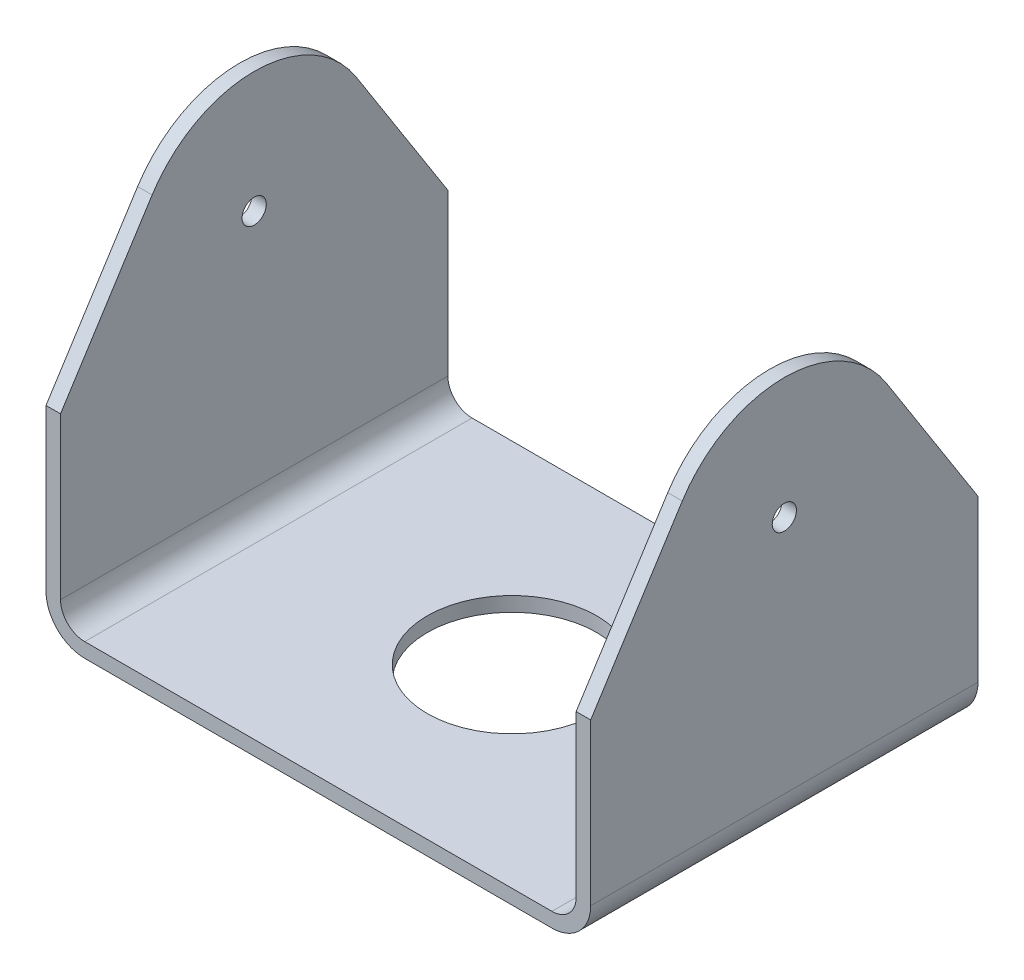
SolidWorks part; units mm, degrees
ref_plane "Plan de face" through (0, 0, 0) normal (0, 0, 1) x (1, 0, 0)
ref_plane "Plan de dessus" through (0, 0, 0) normal (0, 1, 0) x (1, 0, 0)
ref_plane "Plan de droite" through (0, 0, 0) normal (1, 0, 0) x (0, 0, -1)
sketch "Esquisse1" plane through (0, 0, 0) normal (0, 0, 1) x (1, 0, 0)
  line L0 (-56.25, 82.5) -> (-56.25, 0)
  line L1 (-56.25, 0) -> (56.25, 0)
  line L2 (56.25, 0) -> (56.25, 82.5)
  dimension "D1" = 112.5
  dimension "D2" = 82.5
extrude "Extru.-Mince1" add sketch "Esquisse1" along normal mid plane 80 thin
sketch "Esquisse2" plane through (0, 3, 0) normal (0, 1, 0) x (-1, 0, 0)
  circle A0 centre (0, 0) radius 17.5
  dimension "D1" = 35
extrude "Enlèv. mat.-Extru.1" cut sketch "Esquisse2" against normal up to next
sketch "Esquisse3" plane through (56.25, 0, 0) normal (1, 0, 0) x (0, 0, -1)
  line L1 (-40, 82.5) -> (40, 82.5) construction
  line L2 (-21.0848, 70.9325) -> (-40, 41.2416)
  line L3 (-40, 8) -> (-40, 82.5) construction
  line L4 (21.0848, 70.9325) -> (40, 41.2416)
  line L5 (40, 8) -> (40, 82.5) construction
  arc A0 (21.0848, 70.9325) -> (-21.0848, 70.9325) centre (0, 57.5) ccw
  dimension "D1" = 25
  dimension "D2" = 65
extrude "Enlèv. mat.-Extru.2" cut sketch "Esquisse3" against normal through all
sketch "Esquisse4" plane through (56.25, 0, 0) normal (1, 0, 0) x (0, 0, -1)
  circle A0 centre (0, 57.5) radius 2.5
  arc A1 (21.0848, 70.9325) -> (-21.0848, 70.9325) centre (0, 57.5) ccw construction
  dimension "D1" = 5
extrude "Enlèv. mat.-Extru.3" cut sketch "Esquisse4" against normal through all
sketch "Esquisse5" plane through (0, 0, 0) normal (1, 0, 0) x (0, 0, -1)
  circle A0 centre (0, 57.5) radius 2.5 construction
  point P0 (0, -32.5)
  dimension "D1" = 90
